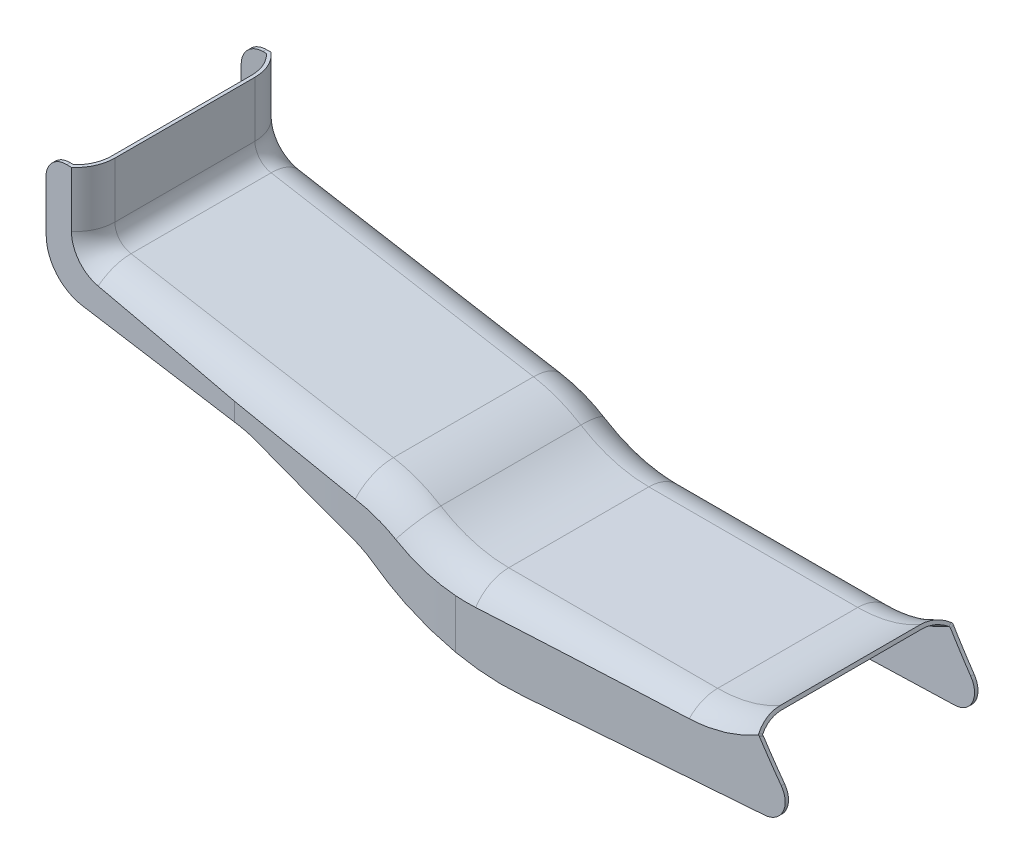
SolidWorks part; units mm, degrees
ref_plane "Front Plane" through (0, 0, 0) normal (0, 0, 1) x (1, 0, 0)
ref_plane "Top Plane" through (0, 0, 0) normal (0, 1, 0) x (1, 0, 0)
ref_plane "Right Plane" through (0, 0, 0) normal (1, 0, 0) x (0, 0, -1)
sketch "Sketch1" plane through (0, 0, 0) normal (0, 0, 1) x (1, 0, 0)
  line L0 (0, 0) -> (-309.2615, 53.5)
  line L1 (136.2042, -44.5) -> (382.4121, -44.5)
  line L2 (-330, 78.1341) -> (-330, 143.5)
  arc A0 (0, 0) -> (55.113, -21.1348) centre (-25.9782, -150.1695) cw
  arc A1 (55.113, -21.1348) -> (136.2042, -44.5) centre (136.2042, 107.9) ccw
  arc A2 (382.4121, -44.5) -> (457, -25) centre (382.4121, 107.9) ccw
  arc A3 (-309.2615, 53.5) -> (-330, 78.1341) centre (-305, 78.1341) cw
  dimension "D1" = 152.4
  dimension "D4" = 25
  dimension "D2" = 44.5
  dimension "D3" = 25
  dimension "D5" = 90
  dimension "D6" = 787
  dimension "D7" = 188
  dimension "D8" = 330
ref_plane "Plane1" through (457, -25, 0) normal (0.872, 0.4894, 0) x (0, 0, -1)
sketch "Sketch2" plane through (457, -25, 0) normal (0.872, 0.4894, 0) x (0, 0, -1)
  line L0 (-82.55, 0) -> (82.55, 0)
  line L1 (0, 0) -> (0, 111.9318) construction
  line L2 (-127, -44.45) -> (-127, -69.85)
  line L3 (127, -44.45) -> (127, -69.85)
  arc A0 (-82.55, 0) -> (-127, -44.45) centre (-82.55, -44.45) ccw
  arc A1 (82.55, 0) -> (127, -44.45) centre (82.55, -44.45) cw
  arc A2 (-127, -69.85) -> (-125.6748, -101.6) centre (254, -69.85) ccw
  arc A3 (127, -69.85) -> (125.6748, -101.6) centre (-254, -69.85) cw
  point P18 (0, 0)
  dimension "D2" = 44.45
  dimension "D4" = 381
  dimension "D1" = 165.1
  dimension "D3" = 101.6
  dimension "D5" = 25.4
surface "Surface-Sweep1"
sketch "Sketch3" plane through (0, 0, 0) normal (0, 1, 0) x (1, 0, 0)
  line L0 (603.1737, 109.1614) -> (113.0529, 120)
  line L1 (-147.5804, 120) -> (-500.0132, 112.2062)
  line L2 (-260.2012, 0) -> (0, 0) construction
  line L3 (615.5455, -108.8878) -> (113.0529, -120)
  line L4 (-147.5804, -120) -> (-500.0132, -112.2062)
  line L5 (498.7636, 166.835) -> (498.7636, -166.835) construction
  arc A0 (113.0529, 120) -> (-147.5804, 120) centre (-17.2638, -5772.9022) ccw
  arc A1 (113.0529, -120) -> (-147.5804, -120) centre (-17.2638, 5772.9022) cw
  dimension "D1" = 120
surface "Surface-Extrude1" sketch "Sketch3" parameters "D1"=500
surface "Surface-Trim1"
surface "Surface-Trim2"
surface "Surface-Trim3"
sketch "Sketch11" plane through (457, -25, 0) normal (0.872, 0.4894, 0) x (0, 0, -1)
  line L0 (82.55, 0) -> (-82.55, 0) construction
  point P0 (53.6929, 218.2176)
  point P1 (0, 245.4669)
  point P2 (0, 245.4669)
  point P4 (0, 0)
sketch "Sketch5" plane through (0, 0, 0) normal (0, 0, 1) x (1, 0, 0)
  line L2 (955.899, -136.7805) -> (955.899, -475.4052) construction
  arc A0 (457, -25) -> (955.899, -389.8649) centre (1142.0431, 388.1778) ccw
  dimension "D1" = 800
surface "Surface-Trim4"
sketch "Sketch13" plane through (0, 0, 0) normal (0, 0, 1) x (1, 0, 0)
  line L0 (-8.2497, -63.0959) -> (-121.0129, -22.0535)
  line L1 (-344.77, 143.5) -> (-374.77, 143.5)
  line L2 (-331.0116, 9.1206) -> (-142.7624, -16.6137)
  line L3 (615.5455, -250) -> (113.0529, -250) construction
  line L4 (-374.77, 143.5) -> (-374.45, 58.5)
  line L5 (190.8729, -127.2461) -> (597.5012, -105.9356)
  arc A0 (18.6611, -77.3808) -> (-8.2497, -63.0959) centre (-45.872, -166.4621) ccw
  arc A1 (-121.0129, -22.0535) -> (-142.7624, -16.6137) centre (-157.951, -123.5403) ccw
  arc A2 (-331.0116, 9.1206) -> (-374.45, 58.5) centre (-324.4504, 58.6883) cw
  arc A3 (18.6611, -77.3808) -> (190.8729, -127.2461) centre (174.1271, 137.2243) ccw
  spline S1 degree 3 poles (-142.7624, -16.6137) (-168.5383, -12.9523) (-196.2879, -9.0815) (-258.5946, -0.5452) (-293.5403, 4.1606) (-331.0116, 9.1206) knots -0.040524 -0.040524 -0.040524 -0.040524 0.5 0.5 1.089208 1.089208 1.089208 1.089208 construction
  spline S25 degree 3 poles (18.6611, -77.3808) (60.83, -107.9291) (110.45, -124.8372) (170.9209, -127.9105) (180.911, -127.8578) (190.8729, -127.2461) knots -2.033296 -2.033296 -2.033296 -2.033296 0.5 0.5 1 1 1 1 construction
  spline S26 degree 3 poles (597.5012, -105.9356) (511.1818, -109.9062) (433.5056, -113.7446) (342.5813, -118.5528) (321.6486, -119.6865) (281.4554, -121.915) (262.1949, -123.01) (225.3141, -125.1591) (207.6938, -126.2132) (190.8729, -127.2461) knots -0.543715 -0.543715 -0.543715 -0.543715 0.25 0.25 0.5 0.5 0.75 0.75 1 1 1 1 construction
  dimension "D3" = 50
  dimension "D5" = 98
  dimension "D6" = 108
  dimension "D4" = 190
  dimension "D2" = 85
  dimension "D8" = 110
  dimension "D9" = 265
  dimension "D1" = 30
  dimension "D7" = 120
  dimension "D10" = 23
  dimension "D11" = 3
surface "Surface-Trim7"
surface "Surface-Knit3"
thicken "Thicken3" surfaces to thicken 122 thickness 2 parameters "D1"=2
fillet "Fillet6" radius 25 8 edges at (516.2433, -110.1942, -111.0838) (-374.77, 143.5, -114.9759) (-374.77, 143.5, 114.9759) (516.2433, -110.1942, 111.0838)
fillet "Fillet7" radius 3 3 edges
fillet "Fillet8" radius 3 4 edges
fillet "Fillet9" radius 3 3 edges
fillet "Fillet10" radius 3 2 edges
